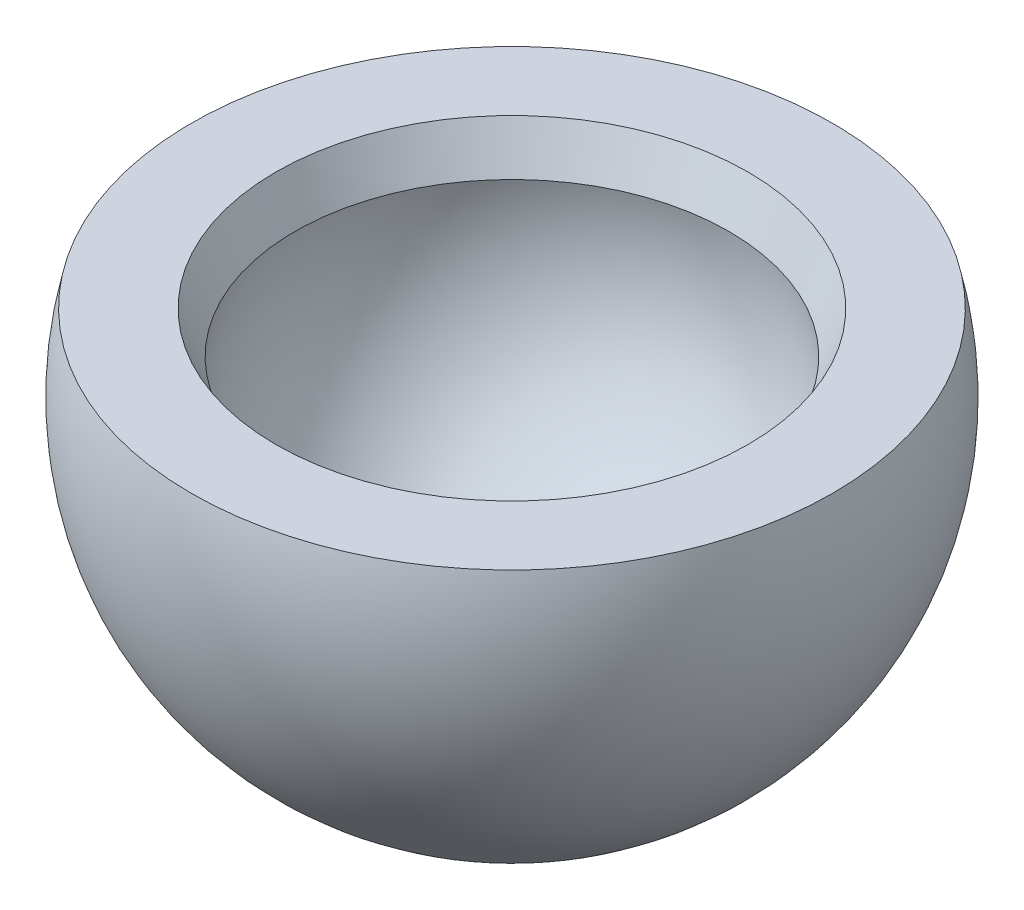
SolidWorks part; units mm, degrees
ref_plane "Front Plane" through (0, 0, 0) normal (0, 0, 1) x (1, 0, 0)
ref_plane "Top Plane" through (0, 0, 0) normal (0, 1, 0) x (1, 0, 0)
ref_plane "Right Plane" through (0, 0, 0) normal (1, 0, 0) x (0, 0, -1)
sketch "Sketch1" plane through (0, 0, 0) normal (0, 0, 1) x (1, 0, 0)
  line L0 (0, 38.1) -> (0, -38.1) construction
  line L1 (0, 38.1) -> (0, -38.1)
  arc A0 (0, -38.1) -> (0, 38.1) centre (0, 0) ccw
  dimension "D1" = 76.2
revolve "Revolve1" add sketch "Sketch1" angle 360 about L0
ref_plane "Plane1" through (0, 8.89, 0) normal (0, 1, 0) x (-1, 0, 0)
sketch "Sketch2" plane through (0, 8.89, 0) normal (0, 1, 0) x (-1, 0, 0)
  circle A0 centre (0, 0) radius 37.8269
  dimension "D1" = 75.6539
extrude "Extrude1" cut sketch "Sketch2" along normal blind 50.8
sketch "Sketch3" plane through (0, 0, 0) normal (0, 1, 0) x (1, 0, 0)
  line L0 (0, 25.4) -> (0, -25.4)
  arc A0 (0, -25.4) -> (0, 25.4) centre (0, 0) ccw
  circle A1 centre (0, 0) radius 38.1 construction
  dimension "D1" = 12.7
revolve "Cut-Revolve1" cut sketch "Sketch3" angle 360 about L0
chamfer "Chamfer1" distance 4.4901 angle 45 1 edges at (0, 8.89, 23.7934)
ref_plane "Plane2" through (0, -16.51, 0) normal (0, 1, 0) x (-1, 0, 0)
